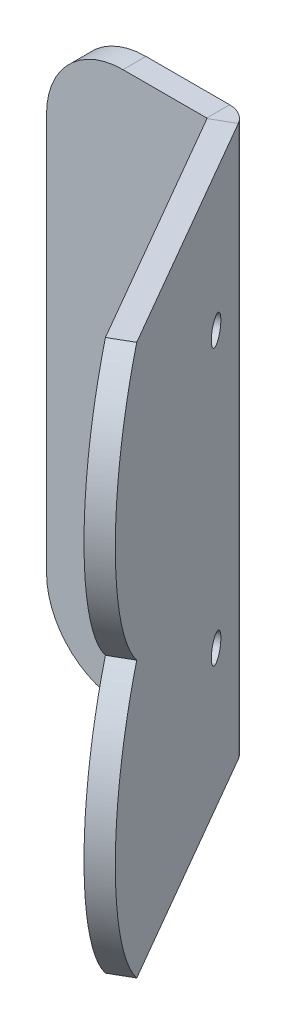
SolidWorks part; units mm, degrees
ref_plane "Front Plane" through (0, 0, 0) normal (0, 0, 1) x (1, 0, 0)
ref_plane "Top Plane" through (0, 0, 0) normal (0, 1, 0) x (1, 0, 0)
ref_plane "Right Plane" through (0, 0, 0) normal (1, 0, 0) x (0, 0, -1)
sketch "Sketch1" plane through (0, 0, 0) normal (0, 0, 1) x (1, 0, 0)
  line L0 (0, 36) -> (57.3494, 36) construction
  line L1 (10, 0) -> (57.3494, 0)
  line L2 (0, 10) -> (0, 62)
  line L3 (10, 72) -> (57.3494, 72)
  line L5 (40, 72) -> (40, 0) construction
  arc A0 (0, 62) -> (10, 72) centre (10, 62) cw
  arc A1 (10, 0) -> (0, 10) centre (10, 10) cw
  arc A2 (57.3494, 36) -> (57.3494, 72) centre (40, 54) ccw
  arc A3 (57.3494, 0) -> (57.3494, 36) centre (40, 18) ccw
  point P9 (0, 0)
  dimension "D1" = 10
  dimension "D4" = 50
  dimension "D2" = 36
  dimension "D3" = 40
  dimension "D5" = 18
  dimension "D6" = 18
sheet metal parameters "Sheet-Metal1" thickness 3 parameters "D1"=1
base flange "Base-Flange1" sketch "Sketch1" thickness 3 reverse thickness direction yes parameters "D1"=1
sketch "Sketch3" plane through (0, 0, 3) normal (0, 0, 1) x (1, 0, 0)
  line L0 (57.3494, 36) -> (0, 36) construction
  line L1 (0, 62) -> (0, 10) construction
  point P0 (29, 54)
  point P1 (29, 18)
  dimension "D1" = 29
  dimension "D2" = 29
  dimension "D3" = 18
  dimension "D4" = 18
hole_wizard "CSK for M3 Countersunk Flat Head Screw1" positions "3DSketch1" profile "Sketch4" countersink size "M3" standard "ISO"
sketch3d "3DSketch1"
  point P0 (29, 54, 3)
  point P3 (29, 18, 3)
sketch "Sketch4" plane through (29, 54, 3) normal (1, 0, 0) x (0, -1, 0)
  line L0 (0, 0) -> (0, 3)
  line L1 (0, 3) -> (1.7, 3)
  line L2 (1.7, 3) -> (1.7, 1.45)
  line L3 (1.7, 1.45) -> (3.15, 0)
  line L5 (3.15, 0) -> (0, 0)
  line L6 (-1.7, 1.45) -> (-3.15, 0) construction
  line L11 (0, -6.35) -> (0, 107.95) construction
  dimension "Thru Hole Dia." = 3.4
  dimension "Thru Hole Depth" = 3
  dimension "Near C'Sink Dia." = 6.3
  dimension "Near C'Sink Angle" = 90
sketch "Sketch5" plane through (0, 0, 3) normal (0, 0, 1) x (1, 0, 0)
  line L0 (21, 72) -> (21, 0)
  line L1 (57.3494, 72) -> (10, 72) construction
  line L2 (10, 0) -> (57.3494, 0) construction
  line L3 (0, 62) -> (0, 10) construction
  dimension "D1" = 21
sketched bend "Sketched Bend1" parameters "D1"=0.1
bend "SketchBend1" bend radius 0.1 bend angle 60 parameters "D5"=1
flat pattern "Flat-Pattern1"
sketch "Bend-Lines1" plane through (0, 0, 0) normal (0, 1, 0) x (-1, 0, 0)
bend of the flat pattern "Flatten-<SketchBend1>1"
